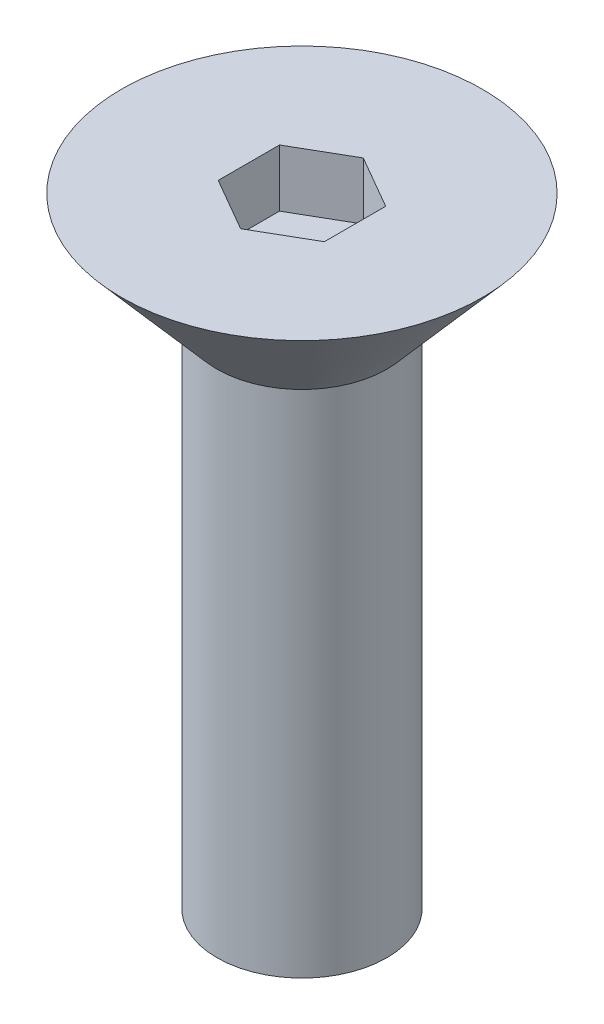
SolidWorks part; units mm, degrees
revolve "Screw" add sketch "Sketch1" angle 360 about L5
sketch "Sketch1" plane through (0, 0, 0) normal (0, 0, 1) x (1, 0, 0)
  line L0 (0, 0) -> (6.7437, 0)
  line L1 (3.175, -4.1053) -> (6.7437, 0)
  line L4 (3.175, -4.1053) -> (3.175, -23.1553)
  line L5 (0, 25.4) -> (0, -50.8) construction
  line L6 (3.175, -23.1553) -> (0, -23.1553)
  line L7 (0, 0) -> (0, -23.1553)
ref_plane "Plane1" through (0, 0, 0) normal (0, 0, 1) x (1, 0, 0)
ref_plane "Plane2" through (0, 0, 0) normal (0, 1, 0) x (1, 0, 0)
ref_plane "Plane3" through (0, 0, 0) normal (1, 0, 0) x (0, 0, -1)
sketch "Sketch2" plane through (0, 0, 0) normal (0, 1, 0) x (-1, 0, 0)
  line L0 (0, -5.08) -> (0, 5.08) construction
  line L1 (23.6537, 0) -> (-27.6225, 0) construction
  line L2 (-1.9844, -1.1457) -> (-1.9844, 1.1457)
  line L3 (0, 2.2914) -> (-1.9844, 1.1457)
  line L4 (0, 2.2914) -> (1.9844, 1.1457)
  line L5 (1.9844, -1.1457) -> (1.9844, 1.1457)
  line L6 (0, -2.2914) -> (-1.9844, -1.1457)
  line L7 (0, -2.2914) -> (1.9844, -1.1457)
  point P8 (-1.9844, 0)
  dimension "D1" = 120
  dimension "HexWidth" = 3.9688
extrude "HexCut" cut sketch "Sketch2" against normal blind 2.1412
sketch "Sketch3" plane through (0, 0, 0) normal (0, 0, 1) x (1, 0, 0)
  line L0 (0, -30.353) -> (0, -38.481) construction
  line L1 (0, 25.4) -> (0, -50.8) construction
  line L2 (2.5908, -31.623) -> (2.5908, -39.624) construction
  line L3 (3.175, -23.1553) -> (3.175, -4.1053) construction
  line L4 (3.175, -23.1553) -> (3.175, -22.5203)
  line L5 (-3.175, -23.1553) -> (3.175, -23.1553) construction
  line L6 (2.5908, -23.1553) -> (3.175, -23.1553)
  line L7 (2.5908, -23.1553) -> (3.175, -22.5203)
revolve "Thread1" [suppressed] cut sketch "Sketch3" angle 360 about L0
sketch "Sketch4" [suppressed] plane through (0, 0, 0) normal (0, 0, 1) x (1, 0, 0)
  line L0 (13.2367, -207.6893) -> (2.3704, -207.6893) construction
  line L1 (3.9688, -207.6893) -> (-3.9688, -207.6893) construction
  line L2 (3.4544, -207.1601) -> (3.9688, -207.6893)
  line L3 (3.9688, -208.2184) -> (3.9688, -207.6893)
  line L4 (3.4544, -208.2184) -> (3.9688, -207.6893)
  line L5 (3.4544, -208.2184) -> (3.9688, -208.2184)
  line L6 (3.9688, -208.2184) -> (3.9688, -207.1601) construction
  line L7 (3.4544, -208.2184) -> (3.9688, -207.6893) construction
  line L8 (3.4544, -208.2184) -> (3.9688, -208.2184) construction
  line L9 (3.4544, -207.1601) -> (3.9688, -207.1601)
  line L10 (3.9688, -207.1601) -> (3.9688, -207.6893)
  line L11 (0, -31.5484) -> (0, -39.4318) construction
  line L12 (0, 25.4) -> (0, -50.8) construction
  point P9 (3.9688, -207.6893)
  dimension "D1" = 0
revolve "Thread2" [suppressed] cut sketch "Sketch4" angle 360 about L11
pattern_linear "Threads" [suppressed]
equation "\"HexDepth@HexCut\" =  ( \"HeadWidth@Sketch1\" - \"NominalDia@Sketch1\" )  *  .3"
equation "\"ThreadWidth@Threads\" =\"ThreadWidth@Sketch3\"  * 2"
